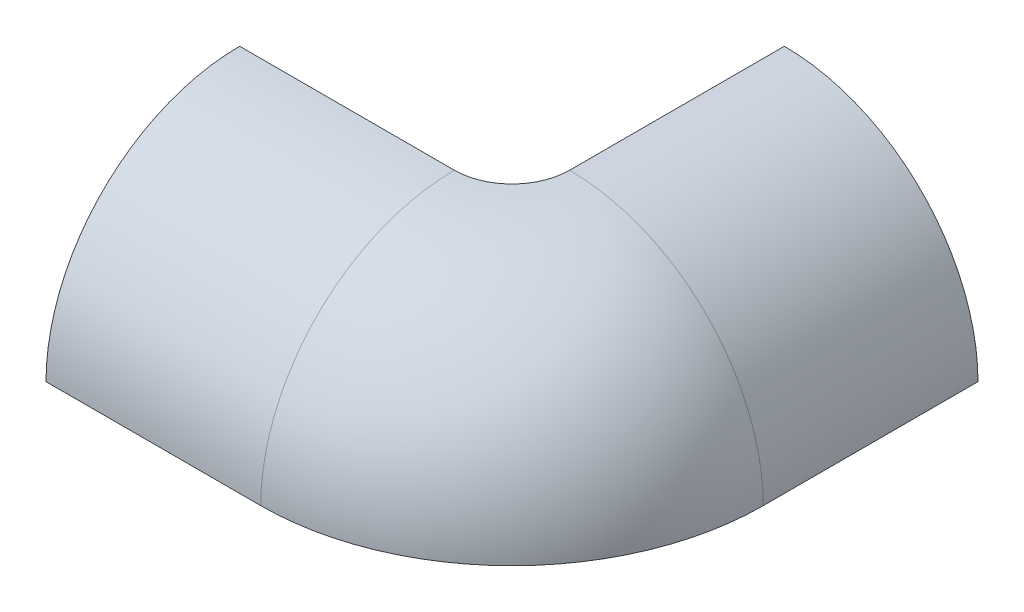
SolidWorks part; units mm, degrees
ref_plane "Front Plane" through (0, 0, 0) normal (0, 0, 1) x (1, 0, 0)
ref_plane "Top Plane" through (0, 0, 0) normal (0, 1, 0) x (1, 0, 0)
ref_plane "Right Plane" through (0, 0, 0) normal (1, 0, 0) x (0, 0, -1)
sketch "Sketch1" plane through (0, 0, 0) normal (1, 0, 0) x (0, 0, -1)
  line L1 (0, 0) -> (-50.8, 0)
  line L2 (0, 0) -> (0, 50.8)
  line L3 (0, 50.8) -> (-50.8, 50.8)
  line L4 (-50.8, 0) -> (-50.8, 50.8)
  dimension "D1" = 50.8
  dimension "D2" = 50.8
sketch "Sketch2" plane through (0, 0, 0) normal (0, 1, 0) x (1, 0, 0)
  line L0 (0, 0) -> (56.3287, 0)
  line L1 (71.439, 15.1104) -> (71.439, 71.439)
  arc A0 (56.3287, 0) -> (71.439, 15.1104) centre (56.3287, 15.1104) ccw
sweep "Sweep1" add profiles "Sketch1" path "Sketch2"
fillet "Fillet1" radius 50.8 3 edges at (122.239, 50.8, -43.2747) (102.9343, 50.8, 31.4953) (28.1643, 50.8, 50.8)
